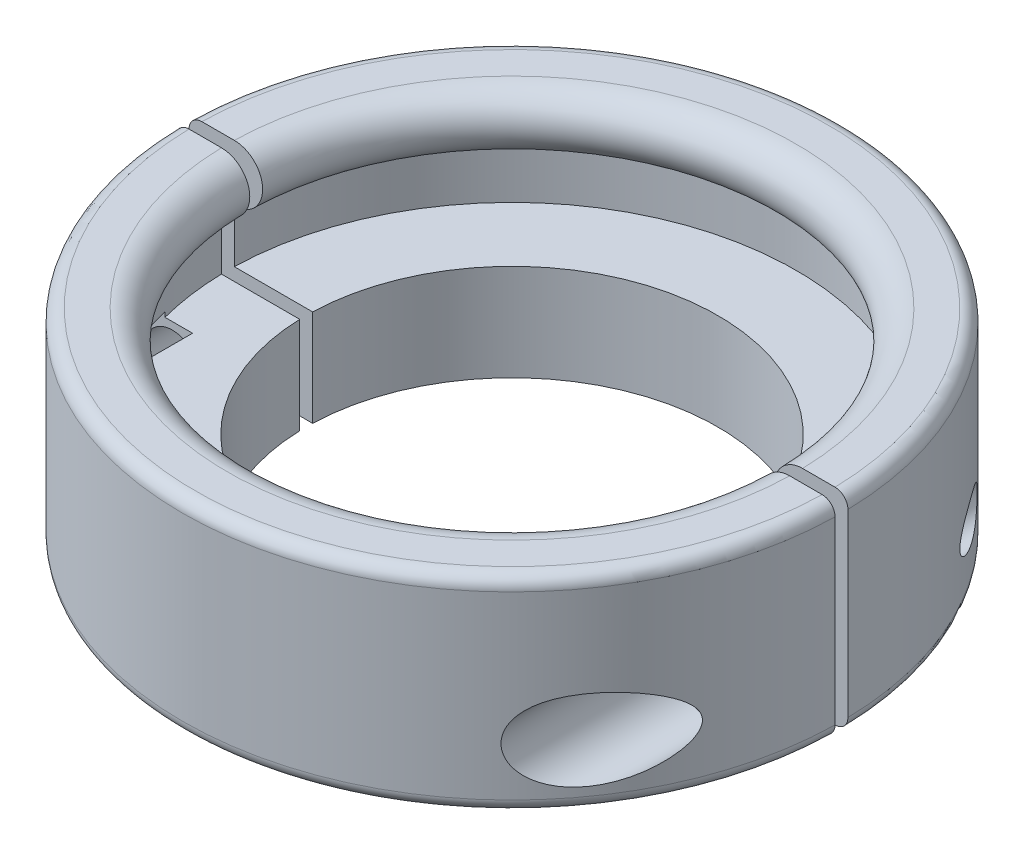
SolidWorks part; units mm, degrees
ref_plane "Front Plane" through (0, 0, 0) normal (0, 0, 1) x (1, 0, 0)
ref_plane "Top Plane" through (0, 0, 0) normal (0, 1, 0) x (1, 0, 0)
ref_plane "Right Plane" through (0, 0, 0) normal (1, 0, 0) x (0, 0, -1)
sketch "Sketch1" plane through (0, 0, 0) normal (0, 0, 1) x (1, 0, 0)
  line L0 (0, 0) -> (40.64, 0) construction
  line L1 (40.64, 0) -> (40.64, -25.4) construction
  line L2 (40.64, -25.4) -> (0, -25.4) construction
  line L3 (0, -25.4) -> (0, 0) construction
  line L4 (35.052, 0) -> (40.64, 0)
  line L5 (40.64, 0) -> (40.64, -25.4)
  line L6 (35.052, -6.985) -> (35.052, -13.4937)
  line L7 (35.052, -13.4937) -> (25.4, -13.4938)
  line L8 (25.4, -13.4938) -> (25.4, -25.4)
  line L9 (25.4, -25.4) -> (40.64, -25.4)
  arc A0 (35.052, 0) -> (35.052, -6.985) centre (35.052, -3.4925) ccw
  dimension "D3" = 3.4925
  dimension "D1" = 40.64
  dimension "D2" = 25.4
  dimension "D4" = 13.4937
  dimension "D5" = 25.4
  dimension "D6" = 35.052
revolve "Revolve1" add sketch "Sketch1" angle 360 about L3
sketch "Sketch2" plane through (0, -25.4, 0) normal (0, -1, 0) x (1, 0, 0)
  line L1 (55, 0) -> (-55, 0) construction
  line L2 (0, -55) -> (0, 55) construction
  line L3 (4.7625, 23.8125) -> (4.7625, 24.9495)
  line L4 (-4.7625, 23.8125) -> (-4.7625, 24.9495)
  arc A0 (-4.7625, 23.8125) -> (4.7625, 23.8125) centre (0, 23.8125) ccw
  circle A1 centre (0, 0) radius 25.4 construction
  circle A2 centre (0, 0) radius 25.4
  dimension "D1" = 9.525
  dimension "D2" = 23.8125
extrude "Boss-Extrude1" add sketch "Sketch2" against normal up to surface (11.9062 mm away) contours L4 A0 L3 M5
fillet "Fillet1" radius 1.5875 2 edges at (-4.7625, -19.4469, 24.9495) (4.7625, -19.4469, 24.9495)
sketch "Sketch3" plane through (0, -25.4, 0) normal (0, -1, 0) x (1, 0, 0)
  line L0 (-25.4, 0) -> (-40.64, 0) construction
  line L1 (-25.3876, 0.7938) -> (-40.6322, 0.7938)
  line L2 (-25.3876, -0.7937) -> (-40.6322, -0.7937)
  line L3 (-25.4, -0.7937) -> (-40.64, -0.7937) construction
  line L4 (-25.4, 0.7938) -> (-40.64, 0.7938) construction
  line L5 (0, 0) -> (0, -25.4)
  line L6 (0, 0) -> (0, -25.4)
  line L7 (25.3876, -0.7938) -> (40.6322, -0.7938)
  line L8 (25.3876, 0.7937) -> (40.6322, 0.7937)
  circle A0 centre (0, 0) radius 40.64 construction
  arc A1 (-6.7129, 24.4969) -> (6.7129, 24.4969) centre (0, 0) ccw construction
  arc A2 (-6.7129, 24.4969) -> (6.7129, 24.4969) centre (0, 0) ccw
  circle A3 centre (0, 0) radius 40.64
  dimension "D1" = 0.7937
  dimension "D3" = 90
  dimension "D2" = 0.7937
extrude "Cut-Extrude1" cut sketch "Sketch3" against normal through all contours L2 L1 M5 M4 | L8 L7 M5 M4
ref_plane "Plane1" through (0, 0, 40.64) normal (0, 0, 1) x (0, -1, 0)
hole_wizard "CBORE for 1/4 Socket Head Cap Screw1" positions "Sketch7" profile "Sketch9" counterbore size "1/4" standard "ANSI Inch"
sketch "Sketch7" plane through (0, 0, 40.64) normal (0, 0, 1) x (0, -1, 0)
  line L7 (0, -40.6322) -> (25.4, -40.6322) construction
  line L8 (25.4, -25.3876) -> (25.4, -40.6322) construction
  line L9 (0, -40.6322) -> (25.4, -40.6322)
  line L10 (25.4, -25.3876) -> (25.4, -40.6322)
  line L11 (25.4, -33.0099) -> (17.7777, -33.0099)
  line L12 (17.7777, -33.0099) -> (17.7777, -40.6322)
  line L14 (17.7777, 33.0099) -> (17.7777, -33.0099)
  line L16 (55, 0) -> (-55, 0) construction
  point P0 (17.7777, -33.0099)
  point P28 (17.7777, 33.0099)
  point P38 (17.7777, 0)
sketch "Sketch9" plane through (-33.0099, -17.7777, 40.64) normal (1, 0, 0) x (0, -1, 0)
  line L0 (0, 0) -> (0, 39.6218)
  line L1 (0, 39.6218) -> (3.3782, 37.592)
  line L2 (3.3782, 37.592) -> (3.3782, 31.75)
  line L3 (3.3782, 31.75) -> (4.9606, 31.75)
  line L4 (4.9606, 31.75) -> (4.9606, 0)
  line L5 (4.9606, 0) -> (0, 0)
  line L10 (0, 39.6218) -> (-3.3782, 37.592) construction
  line L11 (0, -6.35) -> (0, 107.95) construction
  dimension "Hole Dia." = 6.7564
  dimension "Hole Depth" = 37.592
  dimension "C'Bore Dia." = 9.9212
  dimension "C'Bore Depth" = 31.75
  dimension "Drill Angle" = 118
hole_wizard "1/4-20 Tapped Hole1" positions "Sketch10" profile "Sketch11" tap size "1/4-20" standard "ANSI Inch"
sketch "Sketch10" plane through (0, 0, -0.7938) normal (0, 0, 1) x (1, 0, 0)
  point P0 (-33.0099, -17.7777)
  point P3 (33.0099, -17.7777)
sketch "Sketch11" plane through (-33.0099, -17.7777, -0.7938) normal (1, 0, 0) x (0, -1, 0)
  line L0 (0, 0) -> (0, 39.8462)
  line L1 (0, 39.8462) -> (2.5527, 39.8462)
  line L2 (2.5527, 39.8462) -> (2.5527, 0)
  line L5 (2.5527, 0) -> (0, 0)
  line L11 (0, -6.35) -> (0, 107.95) construction
  dimension "Thru Tap Drill Dia." = 5.1054
  dimension "Thru Tap Drill Depth" = 39.8462
fillet "Fillet2" radius 1.5875 2 edges at (0, 0, -40.64) (0, -25.4, -40.64)
fillet "Fillet3" radius 1.5875 2 edges at (0, 0, 40.64) (0, -25.4, 40.64)
